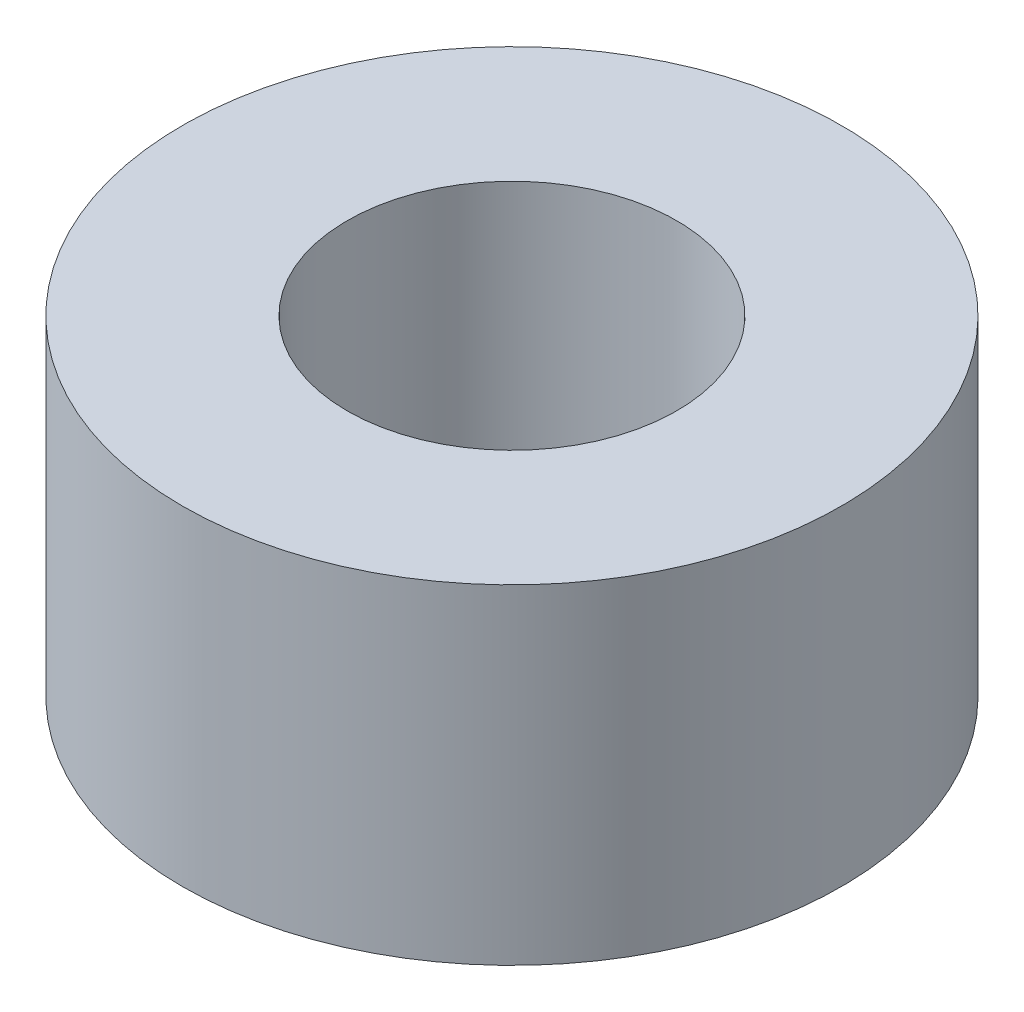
SolidWorks part; units mm, degrees
ref_plane "Front Plane" through (0, 0, 0) normal (0, 0, 1) x (1, 0, 0)
ref_plane "Top Plane" through (0, 0, 0) normal (0, 1, 0) x (1, 0, 0)
ref_plane "Right Plane" through (0, 0, 0) normal (1, 0, 0) x (0, 0, -1)
sketch "Sketch1" plane through (0, 0, 0) normal (0, 1, 0) x (1, 0, 0)
  circle A0 centre (0, 0) radius 10
  circle A1 centre (0, 0) radius 5
  dimension "D1" = 10
  dimension "D2" = 20
extrude "Boss-Extrude1" add sketch "Sketch1" along normal blind 10
